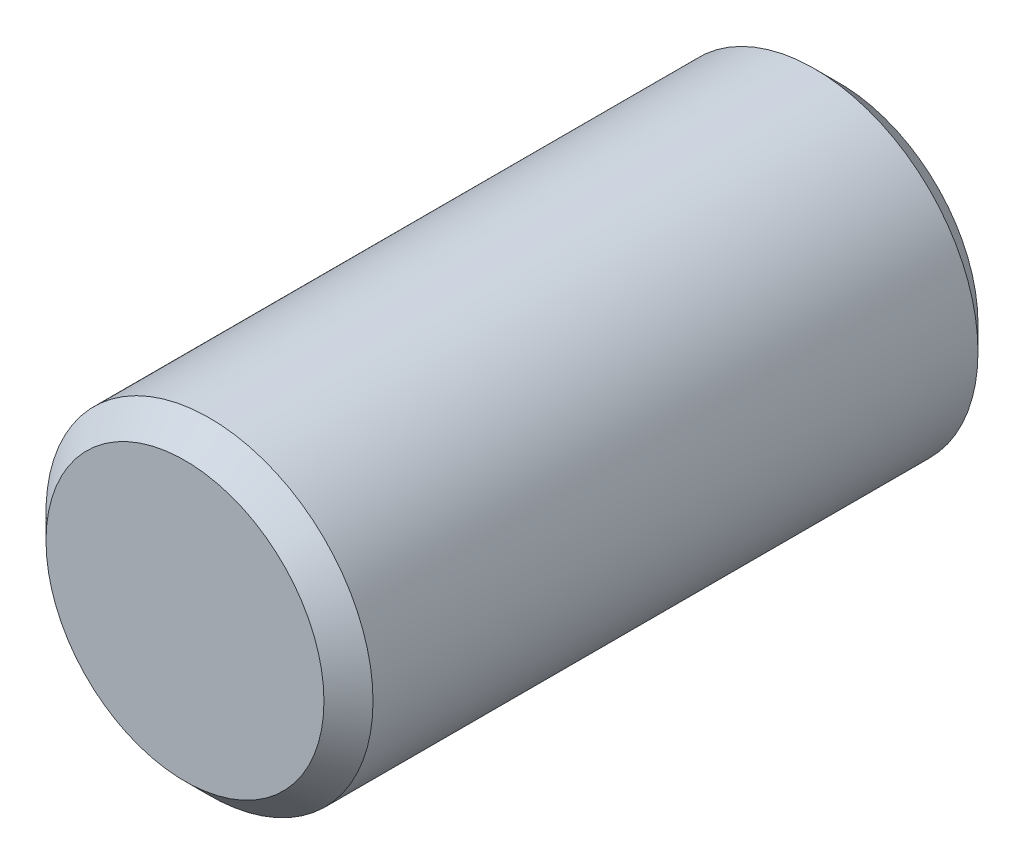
SolidWorks part; units mm, degrees
ref_plane "Face" through (0, 0, 0) normal (0, 0, 1) x (1, 0, 0)
ref_plane "Dessus" through (0, 0, 0) normal (0, 1, 0) x (1, 0, 0)
ref_plane "Côté" through (0, 0, 0) normal (1, 0, 0) x (0, 0, -1)
sketch "Esquisse1" plane through (0, 0, 0) normal (0, 0, 1) x (1, 0, 0)
  circle A0 centre (0, 0) radius 2
extrude "Base-Extrusion" add sketch "Esquisse1" against normal blind 8
sketch "Esquisse2" plane through (0, 0, -8) normal (0, 0, -1) x (-1, 0, 0)
  line L0 (50, 0) -> (-50, 0) construction
  line L1 (1.1547, 0) -> (0.5774, 1)
  line L2 (0.5774, 1) -> (-0.5774, 1)
  line L3 (-0.5774, 1) -> (-1.1547, 0)
  line L4 (-1.1547, 0) -> (-0.5774, -1)
  line L5 (-0.5774, -1) -> (0.5774, -1)
  line L6 (0.5774, -1) -> (1.1547, 0)
  circle A0 centre (0, 0) radius 1 construction
  dimension "D1" = 2
extrude "Enlèv. mat.-Extru.1" cut sketch "Esquisse2" against normal blind 2
chamfer "Chanfrein1" distance 0.3 angle 45 2 edges at (2, 0, -8) (2, 0, 0)
equation "\"D1@Chanfrein1\"  =(\"d Nom.@Esquisse1\"-\"d1@Représentation de filetage1\")/2"
